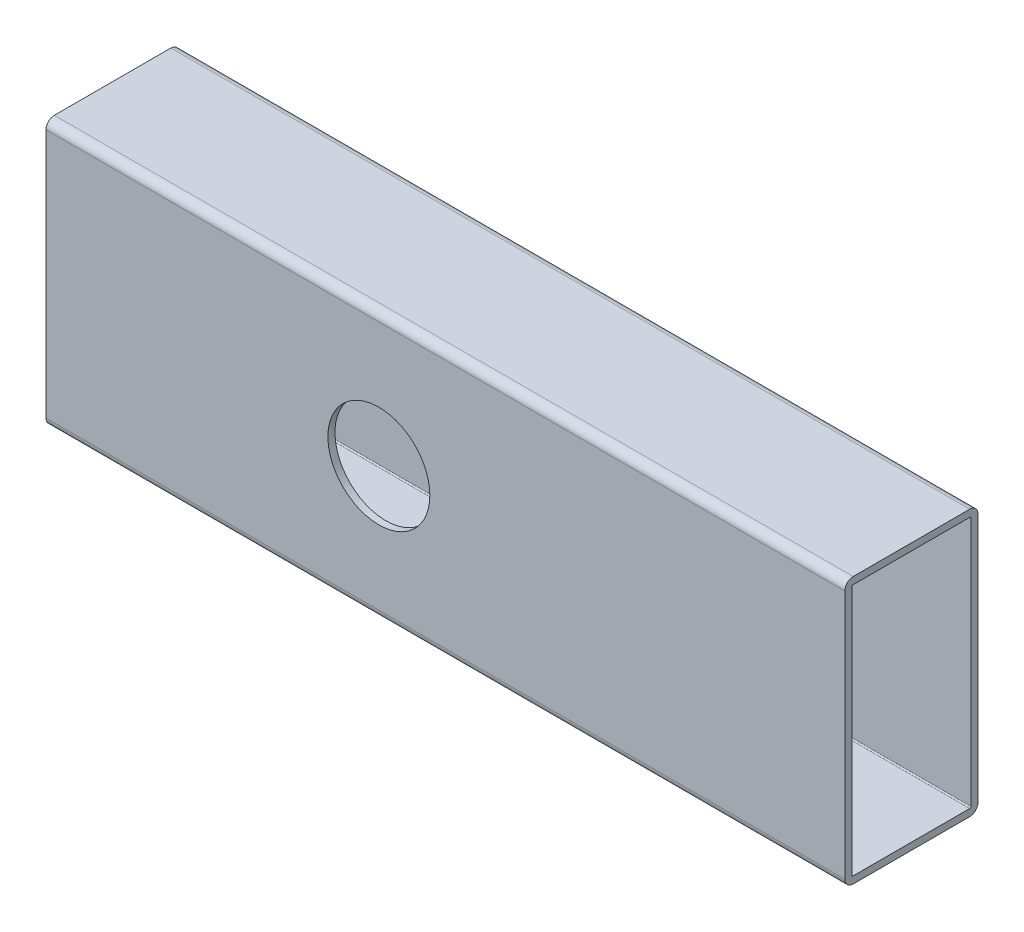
SolidWorks part; units mm, degrees
ref_plane "Front Plane" through (0, 0, 0) normal (0, 0, 1) x (1, 0, 0)
ref_plane "Top Plane" through (0, 0, 0) normal (0, 1, 0) x (1, 0, 0)
ref_plane "Right Plane" through (0, 0, 0) normal (1, 0, 0) x (0, 0, -1)
sketch "Sketch1" plane through (0, 0, 0) normal (1, 0, 0) x (0, 0, -1)
  line L0 (-5.373, 3.898) -> (16.852, 3.898)
  line L1 (-5.373, 5.2442) -> (16.852, 5.2442)
  line L2 (-6.9605, 3.6567) -> (-6.9605, -43.9683)
  line L3 (-5.373, -45.5558) -> (16.852, -45.5558)
  line L4 (18.4395, 3.6567) -> (18.4395, -43.9683)
  line L5 (17.0933, 3.6567) -> (17.0933, -43.9683)
  line L6 (-5.373, -44.2096) -> (16.852, -44.2096)
  line L7 (-5.6143, 3.6567) -> (-5.6143, -43.9683)
  arc A0 (16.852, 5.2442) -> (18.4395, 3.6567) centre (16.852, 3.6567) cw
  arc A1 (-6.9605, 3.6567) -> (-5.373, 5.2442) centre (-5.373, 3.6567) cw
  arc A2 (-5.373, -45.5558) -> (-6.9605, -43.9683) centre (-5.373, -43.9683) cw
  arc A3 (18.4395, -43.9683) -> (16.852, -45.5558) centre (16.852, -43.9683) cw
  arc A4 (16.852, 3.898) -> (17.0933, 3.6567) centre (16.852, 3.6567) cw
  arc A5 (17.0933, -43.9683) -> (16.852, -44.2096) centre (16.852, -43.9683) cw
  arc A6 (-5.373, -44.2096) -> (-5.6143, -43.9683) centre (-5.373, -43.9683) cw
  arc A7 (-5.6143, 3.6567) -> (-5.373, 3.898) centre (-5.373, 3.6567) cw
  point P6 (18.4395, 5.2442)
  point P9 (-6.9605, 5.2442)
  point P14 (18.4395, -45.5558)
  dimension "D3" = 1.5875
  dimension "D1" = 25.4
  dimension "D2" = 50.8
  dimension "D4" = 1.3462
extrude "Extrude1" add sketch "Sketch1" along normal blind 152.4
sketch "Sketch3" plane through (0, 0, -17.0933) normal (0, 0, 1) x (1, 0, 0)
  line L0 (0, -43.9683) -> (0, 3.6567) construction
  line L1 (152.4, 5.2442) -> (0, 5.2442) construction
  circle A0 centre (63.5, -20.1558) radius 9.7234
  dimension "D3" = 19.4469
  dimension "D1" = 63.5
  dimension "D2" = 25.4
extrude "Cut-Extrude1" cut sketch "Sketch3" against normal through all and the other way through all
